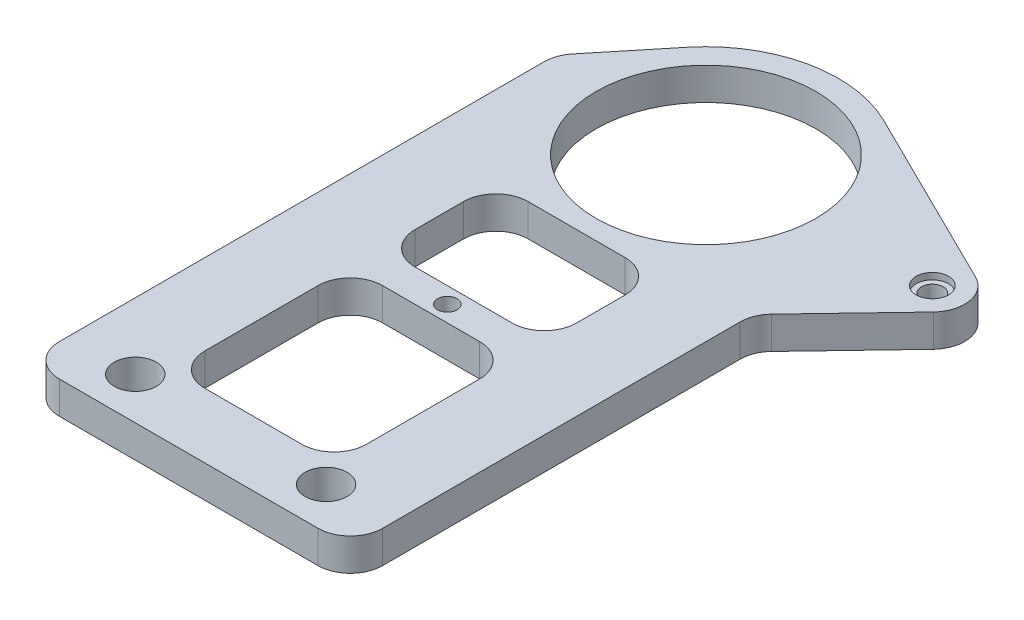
SolidWorks part; units mm, degrees
ref_plane "Plan1" through (0, 0, 0) normal (0, 0, 1) x (1, 0, 0)
ref_plane "Plan2" through (0, 0, 0) normal (0, 1, 0) x (1, 0, 0)
ref_plane "Plan3" through (0, 0, 0) normal (1, 0, 0) x (0, 0, -1)
sketch "Esquisse1" plane through (0, 0, 0) normal (0, 1, 0) x (1, 0, 0)
  line L0 (0, -125.2958) -> (0, 16.3192) construction
  line L1 (-48.3796, 0) -> (124.4123, 0) construction
  line L2 (70, -23.0429) -> (70, 21.0961) construction
  line L3 (-50, -150) -> (-50, 0)
  line L5 (52.7683, -32.5215) -> (77.2317, -6.9067)
  line L6 (40, -160) -> (-40, -160)
  line L7 (-15, -75) -> (15, -75)
  line L8 (50, -150) -> (50, -39.4281)
  line L9 (-53.4152, -80) -> (60.419, -80) construction
  line L10 (25, -130) -> (25, -95)
  line L11 (74.4286, 8.9659) -> (18.1571, 36.7603)
  line L12 (-25, -95) -> (-25, -130)
  line L13 (-15, -85) -> (15, -85)
  line L14 (-15, -140) -> (15, -140)
  line L16 (-25, -65) -> (-25, -50)
  line L17 (-47.75, 6.3196) -> (-31.775, 25.9104)
  line L19 (25, -50) -> (25, -65)
  line L20 (15, -40) -> (-15, -40)
  circle A0 centre (70, 0) radius 2.5
  arc A1 (77.2317, -6.9067) -> (74.4286, 8.9659) centre (70, 0) ccw
  arc A2 (50, -39.4281) -> (52.7683, -32.5215) centre (60, -39.4281) cw
  arc A3 (15, -75) -> (25, -65) centre (15, -65) ccw
  circle A4 centre (0, 0) radius 34
  arc A5 (-15, -75) -> (-25, -65) centre (-15, -65) cw
  arc A6 (-15, -85) -> (-25, -95) centre (-15, -95) ccw
  circle A8 centre (29.5, -147) radius 6.3
  circle A9 centre (-29.5, -147) radius 6.3
  arc A10 (-40, -160) -> (-50, -150) centre (-40, -150) cw
  arc A11 (40, -160) -> (50, -150) centre (40, -150) ccw
  arc A12 (15, -85) -> (25, -95) centre (15, -95) cw
  arc A13 (-47.75, 6.3196) -> (-50, 0) centre (-40, 0) ccw
  arc A14 (15, -140) -> (25, -130) centre (15, -130) ccw
  arc A15 (-15, -140) -> (-25, -130) centre (-15, -130) cw
  circle A16 centre (0, -80) radius 2.9
  arc A17 (18.1571, 36.7603) -> (-31.775, 25.9104) centre (0, 0) ccw
  arc A18 (25, -50) -> (15, -40) centre (15, -50) ccw
  arc A19 (-25, -50) -> (-15, -40) centre (-15, -50) cw
  dimension "D1" = 20
  dimension "D2" = 59
  dimension "D3" = 70
  dimension "D4" = 147
  dimension "D9" = 12.6
  dimension "D10" = 10
  dimension "D11" = 10
  dimension "D13" = 100
  dimension "D6" = 10
  dimension "D7" = 10
  dimension "D8" = 68
  dimension "D5" = 5
  dimension "D15" = 80
  dimension "D18" = 10
  dimension "D21" = 82
  dimension "D23" = 10
  dimension "D20" = 5.8
  dimension "D14" = 46.317
  dimension "D16" = 50
  dimension "D17" = 40
  dimension "D19" = 160
extrude "Base-Extrusion" add sketch "Esquisse1" along normal blind 10
sketch "Esquisse2" plane through (0, 0, 0) normal (0, 1, 0) x (1, 0, 0)
  circle A0 centre (0, 0) radius 27.5
  circle A1 centre (0, -80) radius 3
  circle A2 centre (29.5, -147) radius 6.5
  circle A3 centre (-29.5, -147) radius 6.5
  circle A4 centre (-29.5, -147) radius 6.3 construction
  circle A5 centre (29.5, -147) radius 6.3 construction
  dimension "D1" = 55
  dimension "D2" = 6
  dimension "D3" = 13
extrude "Enlèv. mat.-Extru.2" cut sketch "Esquisse2" along normal through all
sketch "Esquisse3" plane through (0, 10, 0) normal (0, 1, 0) x (-1, 0, 0)
  circle A0 centre (-70, 0) radius 5
  dimension "D1" = 10
extrude "Enlèv. mat.-Extru.3" cut sketch "Esquisse3" against normal blind 2
sketch "Esquisse4" plane through (0, 10, 0) normal (0, 1, 0) x (-1, 0, 0)
  circle A0 centre (-70, 0) radius 3.375
  circle A1 centre (-70, 0) radius 2.5 construction
  dimension "D1" = 6.75
extrude "Enlèv. mat.-Extru.4" cut sketch "Esquisse4" against normal through all
